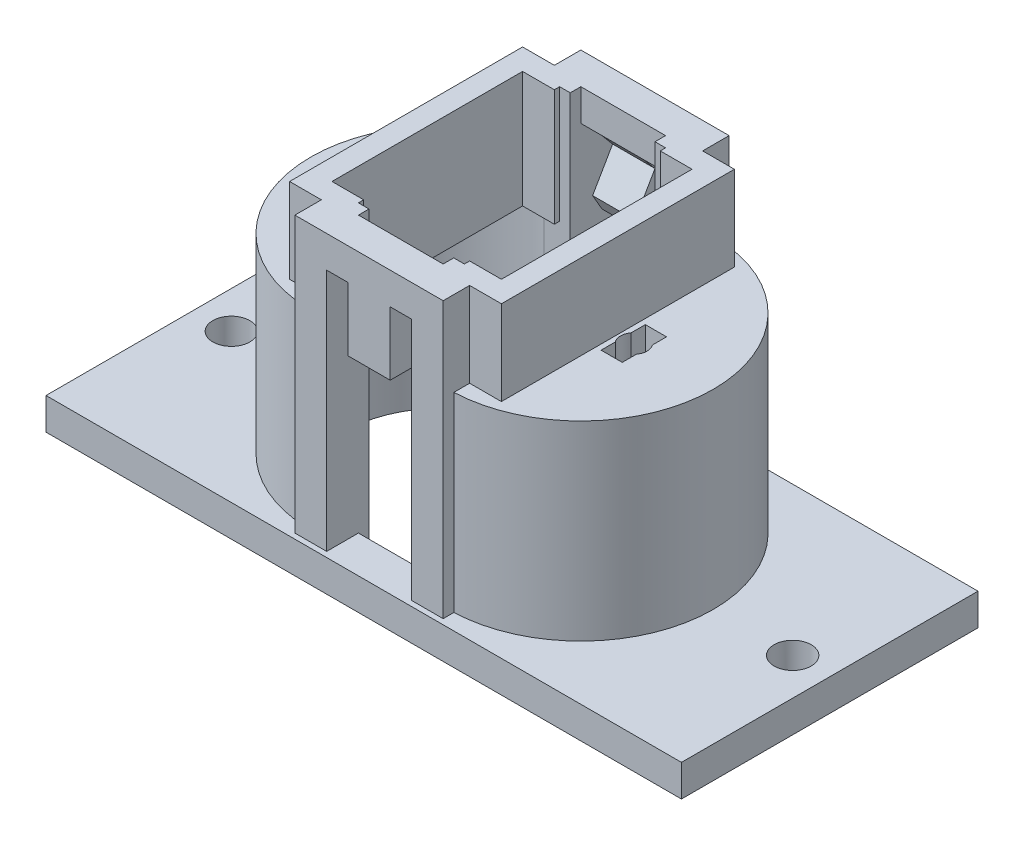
SolidWorks part; units mm, degrees
ref_plane "Front Plane" through (0, 0, 0) normal (0, 0, 1) x (1, 0, 0)
ref_plane "Top Plane" through (0, 0, 0) normal (0, 1, 0) x (1, 0, 0)
ref_plane "Right Plane" through (0, 0, 0) normal (1, 0, 0) x (0, 0, -1)
sketch "Sketch1" plane through (0, 0, 0) normal (0, 1, 0) x (1, 0, 0)
  line L0 (-6.5, 0) -> (6.5, 0) construction
  line L1 (-6.5, 9.5) -> (-4, 9.5)
  line L2 (-6.5, -9.5) -> (-4, -9.5)
  line L3 (0, 0) -> (0, 9.5) construction
  line L4 (-4, 10.5) -> (4, 10.5)
  line L5 (-4, 10.5) -> (-4, 9.5)
  line L7 (4, 10.5) -> (4, 9.5)
  line L8 (0, 0) -> (-16, 0) construction
  line L10 (4, -10.5) -> (4, -9.5)
  line L11 (-4, -10.5) -> (4, -10.5)
  line L12 (-4, -10.5) -> (-4, -9.5)
  line L13 (4, 9.5) -> (6.5, 9.5)
  line L14 (-30, -14) -> (30, -14)
  line L15 (-30, -14) -> (-30, 14)
  line L16 (-30, 14) -> (30, 14)
  line L17 (30, -14) -> (30, 14)
  line L18 (-30, -14) -> (30, 14) construction
  line L19 (-30, 14) -> (30, -14) construction
  line L20 (4, -9.5) -> (6.5, -9.5)
  arc A0 (-6.5, 9.5) -> (-6.5, -9.5) centre (-6.5, 0) ccw
  arc A1 (6.5, -9.5) -> (6.5, 9.5) centre (6.5, 0) ccw
  circle A2 centre (-27, 12) radius 1.5 construction
  circle A3 centre (27, 12) radius 1.5 construction
  circle A4 centre (27, -12) radius 1.5 construction
  circle A5 centre (-27, -12) radius 1.5 construction
  point P2 (0, 0)
  point P7 (-16, 0)
  point P9 (16, 0)
  dimension "D7" = 3
  dimension "D8" = 54
  dimension "D10" = 9.5
  dimension "D1" = 19
  dimension "D2" = 32
  dimension "D3" = 8
  dimension "D4" = 21
  dimension "D5" = 60
  dimension "D6" = 28
  dimension "D9" = 24
extrude "Boss-Extrude1" add sketch "Sketch1" along normal blind 3 contours L14 L17 L16 L15 A3 A2 A1 L2 L10 L11 L12 A0 L1 L5 L4 L7 A4 A5
sketch "Sketch2" plane through (0, 3, 0) normal (0, 1, 0) x (1, 0, 0)
  line L0 (-6.5, -9.5) -> (-4, -9.5) construction
  line L1 (-4, -10.5) -> (-4, -9.5) construction
  line L2 (-4, -10.5) -> (4, -10.5) construction
  line L3 (4, -9.5) -> (6.5, -9.5) construction
  line L7 (-4, 10.5) -> (4, 10.5) construction
  line L8 (-4, 10.5) -> (-4, 9.5) construction
  line L9 (-6.5, 9.5) -> (-4, 9.5) construction
  line L10 (-6.5, -9.5) -> (-4, -9.5)
  line L11 (-4, -10.5) -> (-4, -9.5)
  line L12 (-4, -10.5) -> (4, -10.5)
  line L13 (4, -10.5) -> (4, -9.5)
  line L14 (4, -9.5) -> (6.5, -9.5)
  line L15 (4, 9.5) -> (6.5, 9.5)
  line L16 (4, 10.5) -> (4, 9.5)
  line L17 (-4, 10.5) -> (4, 10.5) construction
  line L18 (-4, 10.5) -> (-4, 9.5) construction
  line L19 (-6.5, 9.5) -> (-4, 9.5)
  line L20 (-7, -12.49) -> (-7, -12.49)
  line L21 (-7, -13.5) -> (-7, -12.49)
  line L22 (-7, -13.5) -> (7, -13.5) construction
  line L23 (7, -13.5) -> (7, -12.49)
  line L24 (7, -12.49) -> (7, -12.49)
  line L25 (7, 12.49) -> (7, 12.49)
  line L26 (7, 13.5) -> (7, 12.49)
  line L27 (-7, 13.5) -> (7, 13.5) construction
  line L28 (-7, 13.5) -> (-7, 12.49)
  line L29 (-7, 12.49) -> (-7, 12.49)
  line L30 (0, 0) -> (-6.5, 0) construction
  line L31 (-6.5, 0) -> (0, 10.5) construction
  line L32 (0, 10.5) -> (0, 0) construction
  line L33 (-7, 13.5) -> (-4, 13.5)
  line L34 (-4, 13.5) -> (-4, 10.5) construction
  line L35 (-4, 13.5) -> (-4, 9.5)
  line L36 (4, 13.5) -> (4, 9.5)
  line L37 (7, 13.5) -> (4, 13.5)
  line L38 (-7, -13.5) -> (-4, -13.5)
  line L39 (-4, -13.5) -> (-4, -9.5)
  line L40 (4, -13.5) -> (4, -9.5)
  line L41 (7, -13.5) -> (4, -13.5)
  line L42 (4, 9.5) -> (6.5, 9.5) construction
  arc A1 (-6.5, 9.5) -> (-6.5, -9.5) centre (-6.5, 0) ccw construction
  arc A2 (6.5, -9.5) -> (6.5, 9.5) centre (6.5, 0) ccw
  arc A3 (-6.5, 9.5) -> (-6.5, -9.5) centre (-6.5, 0) ccw
  arc A4 (-7, 12.49) -> (-7, -12.49) centre (-6.5, 0) ccw
  arc A5 (7, -12.49) -> (7, 12.49) centre (6.5, 0) ccw
  arc A6 (6.5, -9.5) -> (6.5, 9.5) centre (6.5, 0) ccw construction
  dimension "D1" = 3
extrude "Boss-Extrude2" add sketch "Sketch2" along normal blind 15 contours L23 A5 L26 L36 L40 M29 M25 M26 M15 M16 M17 M27 | L28 A4 L21 L39 L35 M27 M19 M20 M21 M22 M23 M29
sketch "Sketch3" plane through (0, 18, 0) normal (0, 1, 0) x (1, 0, 0)
  line L0 (-7, 13.5) -> (-7, 12.49) construction
  line L1 (-7, -12.49) -> (-7, -13.5) construction
  line L3 (-4, -13.5) -> (-4, -9.5) construction
  line L4 (-4, -9.5) -> (-6.5, -9.5) construction
  line L6 (-4, 9.5) -> (-4, 13.5) construction
  line L8 (7, -13.5) -> (7, -12.49) construction
  line L9 (7, 12.49) -> (7, 13.5) construction
  line L11 (4, 13.5) -> (4, 9.5) construction
  line L12 (4, 9.5) -> (6.5, 9.5) construction
  line L14 (4, -9.5) -> (4, -13.5) construction
  line L16 (-7, 13.5) -> (-7, 12.49)
  line L17 (-7, -12.49) -> (-7, -13.5)
  line L18 (-7, -13.5) -> (-4, -13.5)
  line L19 (-4, -13.5) -> (-4, -9.5) construction
  line L20 (-4, -9.5) -> (-6.5, -9.5) construction
  line L21 (-6.5, 9.5) -> (-4, 9.5) construction
  line L22 (-4, 9.5) -> (-4, 13.5) construction
  line L23 (-4, 13.5) -> (-7, 13.5)
  line L24 (7, -13.5) -> (7, -12.49)
  line L25 (7, 12.49) -> (7, 13.5)
  line L26 (7, 13.5) -> (4, 13.5) construction
  line L27 (4, 13.5) -> (4, 9.5) construction
  line L28 (4, 9.5) -> (6.5, 9.5) construction
  line L29 (6.5, -9.5) -> (4, -9.5) construction
  line L30 (4, -9.5) -> (4, -13.5) construction
  line L31 (4, -13.5) -> (7, -13.5)
  line L32 (0, 0) -> (-7, 0) construction
  line L33 (7, -8) -> (4, -8)
  line L34 (7, -8) -> (7, 8)
  line L35 (7, 8) -> (4, 8)
  line L36 (-7, -8) -> (-7, 8)
  line L37 (7, -8) -> (-7, 8) construction
  line L38 (7, 8) -> (-7, -8) construction
  line L39 (0, 0) -> (0, 10.5) construction
  line L41 (-4, 10.5) -> (4, 10.5)
  line L42 (-4, 10.5) -> (-4, 8) construction
  line L44 (4, 10.5) -> (4, 8) construction
  line L45 (4, -10.5) -> (4, -8) construction
  line L46 (-4, -10.5) -> (4, -10.5)
  line L47 (-4, -10.5) -> (-4, -8) construction
  line L48 (-4, 8) -> (-7, 8)
  line L49 (-4, -8) -> (-7, -8)
  line L50 (-4, 8) -> (-4, 9.5) construction
  line L51 (-4, -8) -> (-4, -9.5) construction
  line L52 (4, 8) -> (4, 9.5) construction
  line L53 (4, -8) -> (4, -9.5) construction
  line L54 (4, 8) -> (4, 13.5)
  line L55 (4, 13.5) -> (7, 13.5)
  line L56 (4, -13.5) -> (4, -8)
  line L57 (-4, -13.5) -> (-4, -9.5) construction
  line L58 (-4, 13.5) -> (-4, 8)
  line L59 (-4, -8) -> (-4, -13.5)
  line L60 (-11.5, 0) -> (11.5, 0) construction
  line L61 (12.5, 2.09) -> (10.5, 2.09)
  line L62 (-12.5, -2.09) -> (-10.5, -2.09)
  line L63 (-12.5, -2.09) -> (-12.5, 2.09)
  line L64 (-12.5, 2.09) -> (-10.5, 2.09)
  line L65 (-10.5, -2.09) -> (-10.5, 2.09)
  line L66 (-12.5, -2.09) -> (-10.5, 2.09) construction
  line L67 (-12.5, 2.09) -> (-10.5, -2.09) construction
  line L68 (10.5, -2.09) -> (10.5, 2.09)
  line L69 (12.5, -2.09) -> (10.5, -2.09)
  line L70 (12.5, -2.09) -> (12.5, 2.09)
  arc A0 (-7, 12.49) -> (-7, -12.49) centre (-6.5, 0) ccw construction
  arc A1 (-6.5, 9.5) -> (-6.5, -9.5) centre (-6.5, 0) ccw construction
  arc A2 (7, -12.49) -> (7, 12.49) centre (6.5, 0) ccw construction
  arc A3 (6.5, -9.5) -> (6.5, 9.5) centre (6.5, 0) ccw construction
  arc A4 (-7, 12.49) -> (-7, -12.49) centre (-6.5, 0) ccw
  arc A5 (-6.5, 9.5) -> (-6.5, -9.5) centre (-6.5, 0) ccw construction
  arc A6 (7, -12.49) -> (7, 12.49) centre (6.5, 0) ccw
  arc A7 (6.5, -9.5) -> (6.5, 9.5) centre (6.5, 0) ccw construction
  circle A8 centre (-11.5, 0) radius 1.25
  circle A9 centre (11.5, 0) radius 1.25
  point P3 (0, 0)
  point P48 (0, 0)
  dimension "D4" = 2.5
  dimension "D1" = 14
  dimension "D2" = 16
  dimension "D3" = 23
  dimension "D5" = 4.18
  dimension "D6" = 2
extrude "Boss-Extrude3" add sketch "Sketch3" along normal blind 3
sketch "Sketch4" plane through (0, 21, 0) normal (0, 1, 0) x (1, 0, 0)
  line L0 (-4, 13.5) -> (-4, 8) construction
  line L1 (-4, 8) -> (-7, 8) construction
  line L2 (-7, -8) -> (-7, 8) construction
  line L3 (-4, -8) -> (-7, -8) construction
  line L4 (-4, -8) -> (-4, -13.5) construction
  line L5 (4, -13.5) -> (4, -8) construction
  line L6 (7, -8) -> (4, -8) construction
  line L7 (7, -8) -> (7, 8) construction
  line L8 (7, 8) -> (4, 8) construction
  line L9 (4, 8) -> (4, 13.5) construction
  line L10 (-4, 13.5) -> (-4, 8)
  line L11 (-4, 8) -> (-7, 8)
  line L12 (-7, -8) -> (-7, 8)
  line L13 (-4, -8) -> (-7, -8)
  line L14 (-4, -8) -> (-4, -13.5)
  line L15 (4, -13.5) -> (4, -8)
  line L16 (7, -8) -> (4, -8)
  line L17 (7, -8) -> (7, 8)
  line L18 (7, 8) -> (4, 8)
  line L19 (4, 8) -> (4, 13.5)
  line L20 (-7, 13.5) -> (-7, 11)
  line L21 (-7, 11) -> (-10, 11)
  line L22 (-10, -11) -> (-10, 11)
  line L23 (-7, -11) -> (-10, -11)
  line L24 (-7, -11) -> (-7, -13.5)
  line L25 (7, -13.5) -> (7, -11)
  line L26 (10, -11) -> (7, -11)
  line L27 (10, -11) -> (10, 11)
  line L28 (10, 11) -> (7, 11)
  line L29 (7, 11) -> (7, 13.5)
  line L30 (-7, 13.5) -> (-4, 13.5)
  line L31 (-4, -13.5) -> (-7, -13.5)
  line L32 (4, 13.5) -> (7, 13.5)
  line L33 (4, -13.5) -> (7, -13.5)
  dimension "D1" = 3
extrude "Boss-Extrude4" add sketch "Sketch4" along normal blind 5
sketch "Sketch5" plane through (0, 26, 0) normal (0, 1, 0) x (1, 0, 0)
  line L0 (7, 11) -> (7, 13.5) construction
  line L1 (10, 11) -> (7, 11) construction
  line L2 (10, -11) -> (10, 11) construction
  line L3 (7, -11) -> (10, -11) construction
  line L4 (7, -13.5) -> (7, -11) construction
  line L5 (-7, -11) -> (-7, -13.5) construction
  line L6 (-10, -11) -> (-7, -11) construction
  line L7 (-10, 11) -> (-10, -11) construction
  line L8 (-7, 11) -> (-10, 11) construction
  line L9 (-7, 13.5) -> (-7, 11) construction
  line L10 (7, 11) -> (7, 13.5)
  line L11 (10, 11) -> (7, 11)
  line L12 (10, -11) -> (10, 11)
  line L13 (7, -11) -> (10, -11)
  line L14 (7, -13.5) -> (7, -11)
  line L15 (-7, -11) -> (-7, -13.5)
  line L16 (-10, -11) -> (-7, -11)
  line L17 (-10, 11) -> (-10, -11)
  line L18 (-7, 11) -> (-10, 11)
  line L19 (-7, 13.5) -> (-7, 11)
  line L20 (-7, 13.5) -> (7, 13.5)
  line L21 (-7, -13.5) -> (7, -13.5)
  line L22 (-7, 8) -> (-4, 8) construction
  line L23 (-7, -8) -> (-7, 8) construction
  line L24 (-4, -8) -> (-7, -8) construction
  line L25 (-4, -10.5) -> (4, -10.5) construction
  line L26 (7, -8) -> (4, -8) construction
  line L27 (7, 8) -> (7, -8) construction
  line L28 (4, 8) -> (7, 8) construction
  line L29 (-4, 10.5) -> (4, 10.5) construction
  line L30 (-7, 8) -> (-4, 8)
  line L31 (-7, -8) -> (-7, 8)
  line L32 (-4, -8) -> (-7, -8)
  line L33 (-4, -10.5) -> (4, -10.5)
  line L34 (7, -8) -> (4, -8)
  line L35 (7, 8) -> (7, -8)
  line L36 (4, 8) -> (7, 8)
  line L37 (-4, 10.5) -> (4, 10.5)
  line L38 (-4, 10.5) -> (4, 10.5)
  line L39 (-4, -10.5) -> (4, -10.5)
  line L40 (-4, 10.5) -> (-4, 8)
  line L41 (4, 8) -> (4, 10.5)
  line L42 (4, -8) -> (4, -10.5)
  line L43 (-4, -10.5) -> (-4, -8)
extrude "Boss-Extrude5" add sketch "Sketch5" along normal blind 8.5 contours M24 M13 M14 M15 M16 M17 M18 M19 M20 M21 M22 M23 | L34 L42 L33 L21 L14 L13 L12 L11 L10 L20 L37 L41 L36 L35 M20 M24
sketch "Sketch6" plane through (0, 0, 0) normal (1, 0, 0) x (0, 0, -1)
  line L0 (-10.5, 26) -> (-13.5, 26)
  line L1 (-10.5, 26) -> (-13.5, 26) construction
  line L2 (13.5, 26) -> (10.5, 26)
  line L3 (13.5, 26) -> (10.5, 26) construction
  line L4 (-13.5, 26) -> (-13.5, 20)
  line L5 (-13.5, 20) -> (-10.5, 20)
  line L6 (-10.5, 20) -> (-9.612, 21.5381)
  line L7 (-9.612, 21.5381) -> (-11.5, 24.8082)
  line L8 (-11.5, 24.8082) -> (-10.5, 26) construction
  line L9 (-10.5, 26) -> (-10.5, 20) construction
  line L10 (0, 0) -> (0, 26) construction
  line L11 (0, 26) -> (-10.5, 26) construction
  line L12 (10.5, 26) -> (10.5, 20) construction
  line L13 (9.612, 21.5381) -> (11.5, 24.8082) construction
  line L14 (10.5, 20) -> (9.612, 21.5381) construction
  line L15 (13.5, 20) -> (10.5, 20) construction
  line L16 (13.5, 26) -> (13.5, 20) construction
  line L17 (10.5, 26) -> (13.5, 26) construction
  line L18 (11.5, 24.8082) -> (10.5, 26) construction
  line L19 (-11.5, 24.8082) -> (-10.5, 26)
  line L20 (-13.5, 26) -> (-10.5, 26)
  line L21 (13.5, 26) -> (13.5, 20)
  line L22 (13.5, 20) -> (10.5, 20)
  line L23 (10.5, 20) -> (9.612, 21.5381)
  line L24 (9.612, 21.5381) -> (11.5, 24.8082)
  line L25 (11.5, 24.8082) -> (10.5, 26)
  line L26 (13.5, 26) -> (10.5, 26)
  dimension "D1" = 60
  dimension "D2" = 120
  dimension "D3" = 2
  dimension "D4" = 50
  dimension "D5" = 6
extrude "Boss-Extrude6" add sketch "Sketch6" along normal mid plane 4 contours L18 L13 L14 L15 L16 L3 | L20 L4 L5 L6 L7 L19 | L21 L26 L25 L24 L23 L22
sketch "Sketch7" plane through (0, 18, 0) normal (0, -1, 0) x (1, 0, 0)
  line L0 (-4, -9.5) -> (-4, -8) construction
  line L1 (-4, -8) -> (-7, -8) construction
  line L2 (4, -8) -> (4, -9.5) construction
  line L3 (7, -8) -> (4, -8) construction
  line L4 (7, 8) -> (7, -8) construction
  line L5 (7, 8) -> (4, 8) construction
  line L6 (4, 9.5) -> (4, 8) construction
  line L7 (-7, 8) -> (-7, -8) construction
  line L8 (-4, 8) -> (-7, 8) construction
  line L9 (-4, 8) -> (-4, 9.5) construction
  line L10 (-4, -9.5) -> (-4, -8)
  line L11 (-4, -8) -> (-7, -8)
  line L12 (4, -8) -> (4, -9.5)
  line L13 (7, -8) -> (4, -8)
  line L14 (7, 8) -> (7, -8)
  line L15 (7, 8) -> (4, 8)
  line L16 (4, 9.5) -> (4, 8)
  line L17 (-7, 8) -> (-7, -8)
  line L18 (-4, 8) -> (-7, 8)
  line L19 (-4, 8) -> (-4, 9.5)
  line L20 (-5, -9.5) -> (-5, -9)
  line L21 (-5, -9) -> (-8, -9)
  line L22 (-8, 9) -> (-8, -9)
  line L23 (-5, 9) -> (-8, 9)
  line L24 (-5, 9) -> (-5, 9.5)
  line L25 (5, 9.5) -> (5, 9)
  line L26 (8, 9) -> (5, 9)
  line L27 (8, 9) -> (8, -9)
  line L28 (8, -9) -> (5, -9)
  line L29 (5, -9) -> (5, -9.5)
  line L30 (-5, 9.5) -> (-4, 9.5)
  line L31 (-5, -9.5) -> (-4, -9.5)
  line L32 (4, -9.5) -> (5, -9.5)
  line L33 (4, 9.5) -> (5, 9.5)
  dimension "D1" = 1
  dimension "D2" = 1
extrude "Cut-Extrude1" cut sketch "Sketch7" against normal up to surface (16.5 mm away)
sketch "Sketch8" plane through (0, 34.5, 0) normal (0, 1, 0) x (1, 0, 0)
  line L12 (7, 11) -> (7, 13.5)
  line L13 (7, 13.5) -> (-7, 13.5)
  line L14 (-7, 13.5) -> (-7, 11)
  line L15 (-7, 11) -> (-10, 11)
  line L16 (-10, 11) -> (-10, -11)
  line L17 (-10, -11) -> (-7, -11)
  line L18 (-7, -11) -> (-7, -13.5)
  line L19 (-7, -13.5) -> (7, -13.5)
  line L20 (7, -13.5) -> (7, -11)
  line L21 (7, -11) -> (10, -11)
  line L22 (10, -11) -> (10, 11)
  line L23 (10, 11) -> (7, 11)
  line L24 (7, 11) -> (7, 13.5)
  line L25 (7, 13.5) -> (-7, 13.5)
  line L26 (-7, 13.5) -> (-7, 11)
  line L27 (-7, 11) -> (-10, 11)
  line L28 (-10, 11) -> (-10, -11)
  line L29 (-10, -11) -> (-7, -11)
  line L30 (-7, -11) -> (-7, -13.5)
  line L31 (-7, -13.5) -> (7, -13.5)
  line L32 (7, -13.5) -> (7, -11)
  line L33 (7, -11) -> (10, -11)
  line L34 (10, -11) -> (10, 11)
  line L35 (10, 11) -> (7, 11)
  dimension "D1" = 0
extrude "Cut-Extrude2" cut sketch "Sketch8" against normal blind 5.5
sketch "Sketch9" plane through (0, 3, 0) normal (0, 1, 0) x (1, 0, 0)
  line L0 (26.5, 0) -> (-26.5, 0) construction
  line L1 (-30, -14) -> (-30, 14) construction
  line L2 (0, 0) -> (0, 7.0605) construction
  circle A0 centre (-26.5, 0) radius 1.75
  circle A1 centre (26.5, 0) radius 1.75
  point P4 (0, 0)
  dimension "D1" = 3.5
  dimension "D2" = 3.5
  dimension "D3" = 53
extrude "Cut-Extrude3" cut sketch "Sketch9" against normal blind 10
